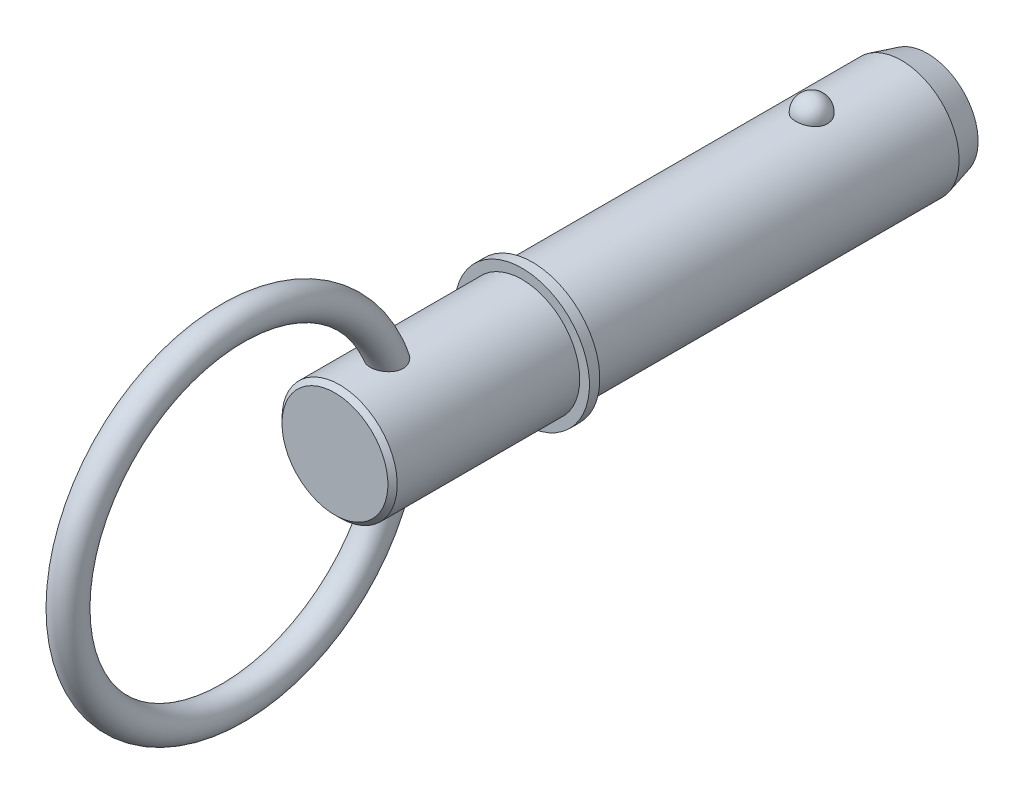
SolidWorks part; units mm, degrees
ref_plane "Front Plane" through (0, 0, 0) normal (0, 0, 1) x (1, 0, 0)
ref_plane "Top Plane" through (0, 0, 0) normal (0, 1, 0) x (1, 0, 0)
ref_plane "Right Plane" through (0, 0, 0) normal (1, 0, 0) x (0, 0, -1)
sketch "Sketch2" plane through (0, 0, 0) normal (0, 0, 1) x (1, 0, 0)
  circle A0 centre (0, 0) radius 11.115
  point P3 (0, 11.115)
  dimension "D1" = 22.23
extrude "Boss-Extrude1" add sketch "Sketch2" along normal blind 50.8
sketch "Sketch3" plane through (0, 0, 0) normal (0, 0, -1) x (-1, 0, 0)
  circle A0 centre (0, 0) radius 11.115
  dimension "D1" = 22.23
extrude "Boss-Extrude2" add sketch "Sketch3" along normal blind 25.4
chamfer "Chamfer1" distance 5 angle 15 1 edges at (-11.115, 0, -25.4)
sketch "Sketch18" plane through (0, 0, 0) normal (1, 0, 0) x (0, 0, -1)
  line L0 (20.4, 11.115) -> (-50.8, 11.115) construction
  line L1 (3.07, 14.185) -> (3.07, 8.045)
  line L2 (-50.8, -11.115) -> (20.4, -11.115) construction
  arc A0 (3.07, 14.185) -> (3.07, 8.045) centre (3.07, 11.115) ccw
  point P4 (0, 11.115)
  dimension "D1" = 25.3
revolve "Revolve1" add sketch "Sketch18" angle 360 about L1
sketch "Sketch19" plane through (0, 0, 0) normal (1, 0, 0) x (0, 0, -1)
  line L0 (-33.7288, 0) -> (-46.4542, 0) construction
sketch "Sketch20" plane through (0, 0, 0) normal (1, 0, 0) x (0, 0, -1)
  line L0 (-50.8, 0) -> (-50.8, 13)
  line L1 (-50.8, 11.115) -> (-50.8, -11.115) construction
  line L2 (-50.8, 13) -> (-52.8, 13)
  line L3 (-52.8, 13) -> (-52.8, 0)
  line L4 (-33.7288, 0) -> (-46.4542, 0) construction
  line L5 (-52.8, 0) -> (-50.8, 0)
  dimension "D1" = 13
  dimension "D2" = 2
revolve "Revolve2" add sketch "Sketch20" angle 360 about L0
sketch "Sketch21" plane through (0, 0, 50.8) normal (0, 0, -1) x (-1, 0, 0)
  circle A0 centre (0, 0) radius 11.115
  dimension "D1" = 22.23
extrude "Boss-Extrude3" add sketch "Sketch21" against normal blind 38.1
chamfer "Chamfer2" distance 0.9 angle 45 1 edges at (-11.115, 0, 88.9)
sketch "Sketch23" plane through (0, 0, 0) normal (1, 0, 0) x (0, 0, -1)
  line L0 (-88.9, 10.215) -> (-88.9, -10.215) construction
  circle A0 centre (-108.65, 0) radius 31.75
  point P2 (-76.9, 0)
  dimension "D1" = 63.5
  dimension "D2" = 12
sketch "Sketch24" plane through (0, 0, 0) normal (0, 1, 0) x (1, 0, 0)
  circle A0 centre (0, -76.9) radius 3
  dimension "D1" = 6
sweep "Sweep1" add profiles "Sketch24" path "Sketch23"
